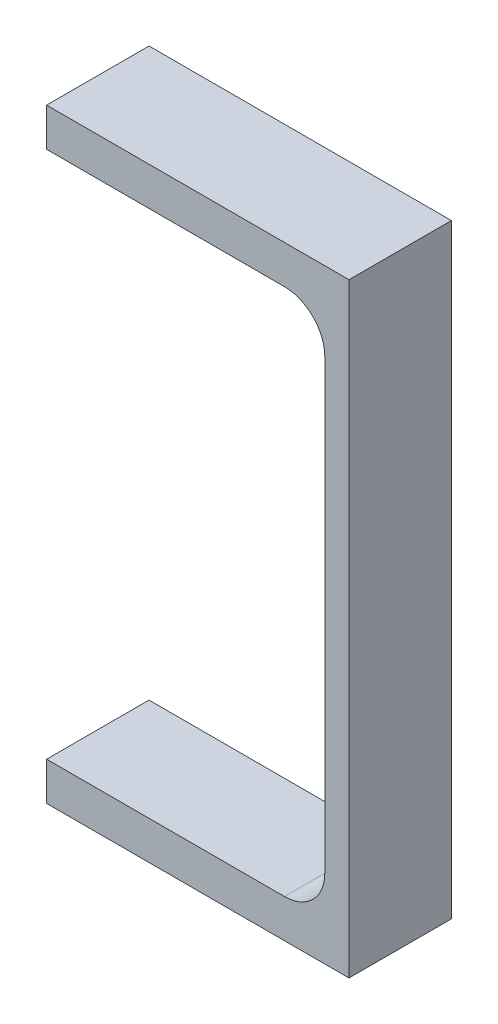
SolidWorks part; units mm, degrees
ref_plane "Front Plane" through (0, 0, 0) normal (0, 0, 1) x (1, 0, 0)
ref_plane "Top Plane" through (0, 0, 0) normal (0, 1, 0) x (1, 0, 0)
ref_plane "Right Plane" through (0, 0, 0) normal (1, 0, 0) x (0, 0, -1)
other "Configuration Table"
sketch "Sketch1" plane through (0, 0, 0) normal (0, 0, 1) x (1, 0, 0)
  line L0 (0, 84.7227) -> (0, -104.0799) construction
  line L1 (-75, 75) -> (0, 75)
  line L2 (-75, 75) -> (-75, 65.5)
  line L3 (-75, -75) -> (0, -75)
  line L4 (0, 75) -> (0, -75)
  line L5 (-42.3074, 0) -> (60.8749, 0) construction
  line L6 (-75, -65.5) -> (-75, -75)
  line L7 (-75, 65.5) -> (-16, 65.5)
  line L9 (-75, -65.5) -> (-16, -65.5)
  line L10 (-6, 55.5) -> (-6, -55.5)
  arc A0 (-16, 65.5) -> (-6, 55.5) centre (-16, 55.5) cw
  arc A1 (-16, -65.5) -> (-6, -55.5) centre (-16, -55.5) ccw
  point P18 (0, -75)
  point P27 (0, 75)
  dimension "Radius" = 10
  dimension "Depth" = 150
  dimension "Width" = 75
  dimension "Web_thickness" = 6
  dimension "Thickness" = 9.5
extrude "BaseSection" add sketch "Sketch1" along normal mid plane 25.4
